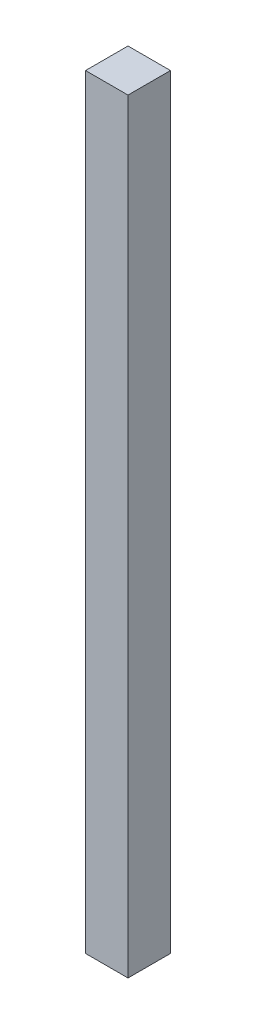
SolidWorks part; units mm, degrees
ref_plane "Front Plane" through (0, 0, 0) normal (0, 0, 1) x (1, 0, 0)
ref_plane "Top Plane" through (0, 0, 0) normal (0, 1, 0) x (1, 0, 0)
ref_plane "Right Plane" through (0, 0, 0) normal (1, 0, 0) x (0, 0, -1)
sketch "Sketch1" plane through (0, 0, 0) normal (0, 1, 0) x (1, 0, 0)
  line L1 (-20, 20) -> (20, 20)
  line L2 (-20, 20) -> (-20, -20)
  line L3 (-20, -20) -> (20, -20)
  line L4 (20, 20) -> (20, -20)
  line L5 (-20, 20) -> (20, -20) construction
  line L6 (-20, -20) -> (20, 20) construction
  point P0 (0, 0)
  dimension "D1" = 40
extrude "Boss-Extrude1" add sketch "Sketch1" along normal blind 720
